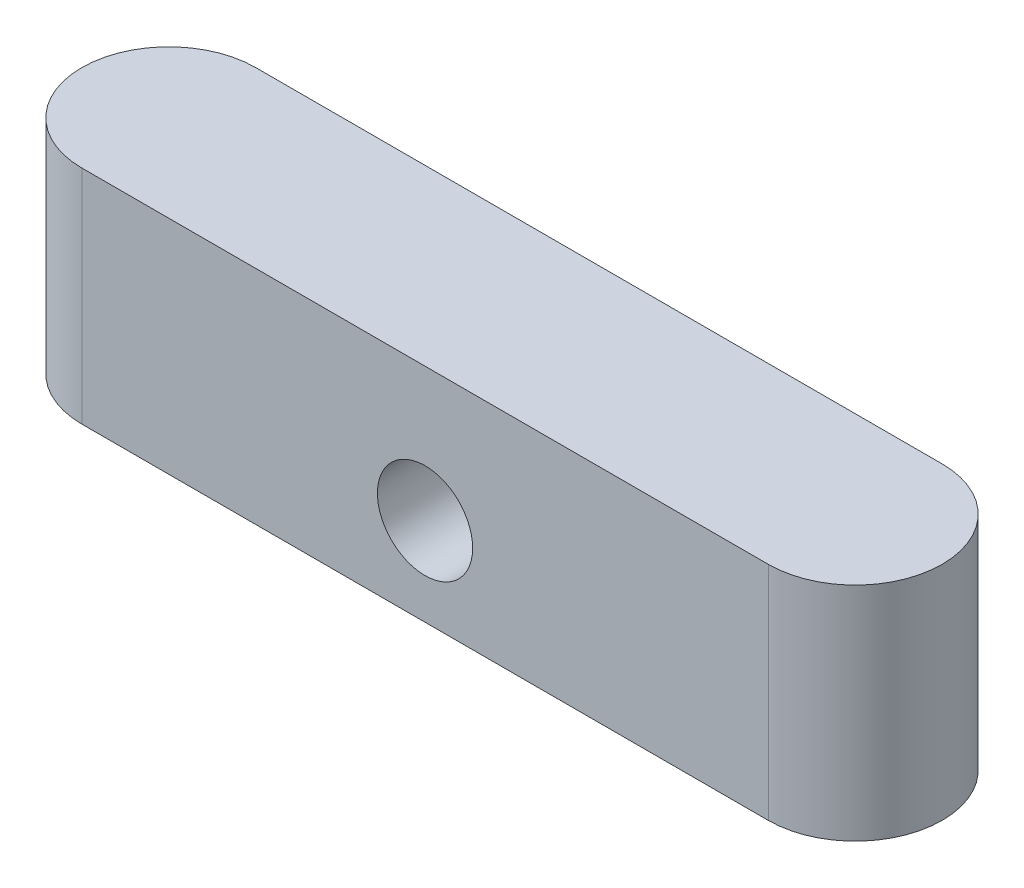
SolidWorks part; units mm, degrees
ref_plane "Front Plane" through (0, 0, 0) normal (0, 0, 1) x (1, 0, 0)
ref_plane "Top Plane" through (0, 0, 0) normal (0, 1, 0) x (1, 0, 0)
ref_plane "Right Plane" through (0, 0, 0) normal (1, 0, 0) x (0, 0, -1)
sketch "Sketch1" plane through (0, 0, 0) normal (0, 1, 0) x (1, 0, 0)
  line L0 (-9.75, 0) -> (9.75, 0) construction
  line L1 (-9.75, 2.4701) -> (9.75, 2.4702)
  line L2 (-9.75, -2.4701) -> (9.75, -2.4701)
  arc A0 (-9.75, 2.4701) -> (-9.75, -2.4701) centre (-9.75, 0) ccw
  arc A1 (9.75, -2.4701) -> (9.75, 2.4702) centre (9.75, 0) ccw
  point P2 (0, 0)
  dimension "D1" = 19.5
  dimension "D2" = 4.9403
extrude "Boss-Extrude1" add sketch "Sketch1" along normal mid plane 6.3
hole_wizard "#6-32 Tapped Hole1" positions "Sketch3" profile "Sketch2" tap size "#6-32" standard "ANSI Inch"
sketch "Sketch3" plane through (0, 0, 2.4701) normal (0, 0, 1) x (1, 0, 0)
  line L0 (-9.75, -3.15) -> (9.75, -3.15) construction
  point P0 (0, -0.65)
  dimension "D1" = 2.5
sketch "Sketch2" plane through (0, -0.65, 2.4701) normal (1, 0, 0) x (0, -1, 0)
  line L0 (0, 0) -> (0, 4.9403)
  line L1 (0, 4.9403) -> (1.3525, 4.9403)
  line L2 (1.3525, 4.9403) -> (1.3525, 0)
  line L5 (1.3525, 0) -> (0, 0)
  line L11 (0, -6.35) -> (0, 107.95) construction
  dimension "Thru Tap Drill Dia." = 2.7051
  dimension "Thru Tap Drill Depth" = 4.9403
